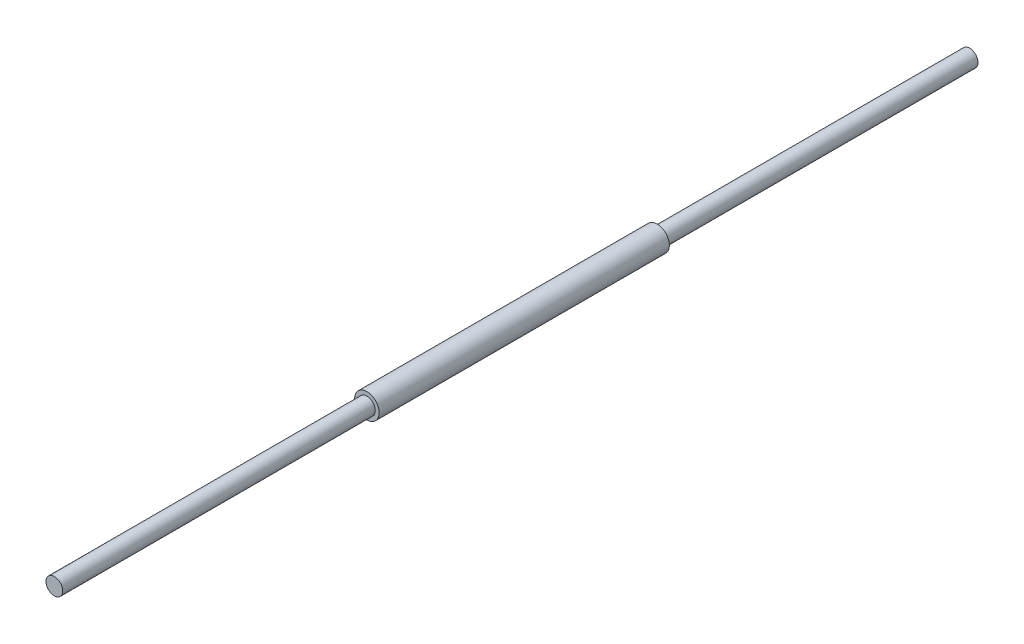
SolidWorks part; units mm, degrees
ref_plane "Front Plane" through (0, 0, 0) normal (0, 0, 1) x (1, 0, 0)
ref_plane "Top Plane" through (0, 0, 0) normal (0, 1, 0) x (1, 0, 0)
ref_plane "Right Plane" through (0, 0, 0) normal (1, 0, 0) x (0, 0, -1)
sketch "Sketch1" plane through (0, 0, 0) normal (0, 0, 1) x (1, 0, 0)
  circle A0 centre (0, 0) radius 4.7625
  dimension "D1" = 9.525
extrude "Boss-Extrude1" add sketch "Sketch1" against normal blind 520.7
ref_plane "Plane1" through (0, 0, -260.35) normal (0, 0, 1) x (1, 0, 0)
sketch "Sketch2" plane through (0, 0, -260.35) normal (0, 0, 1) x (1, 0, 0)
  circle A0 centre (0, 0) radius 6.985
  dimension "D1" = 13.97
extrude "Boss-Extrude2" add sketch "Sketch2" along normal mid plane 165.1
